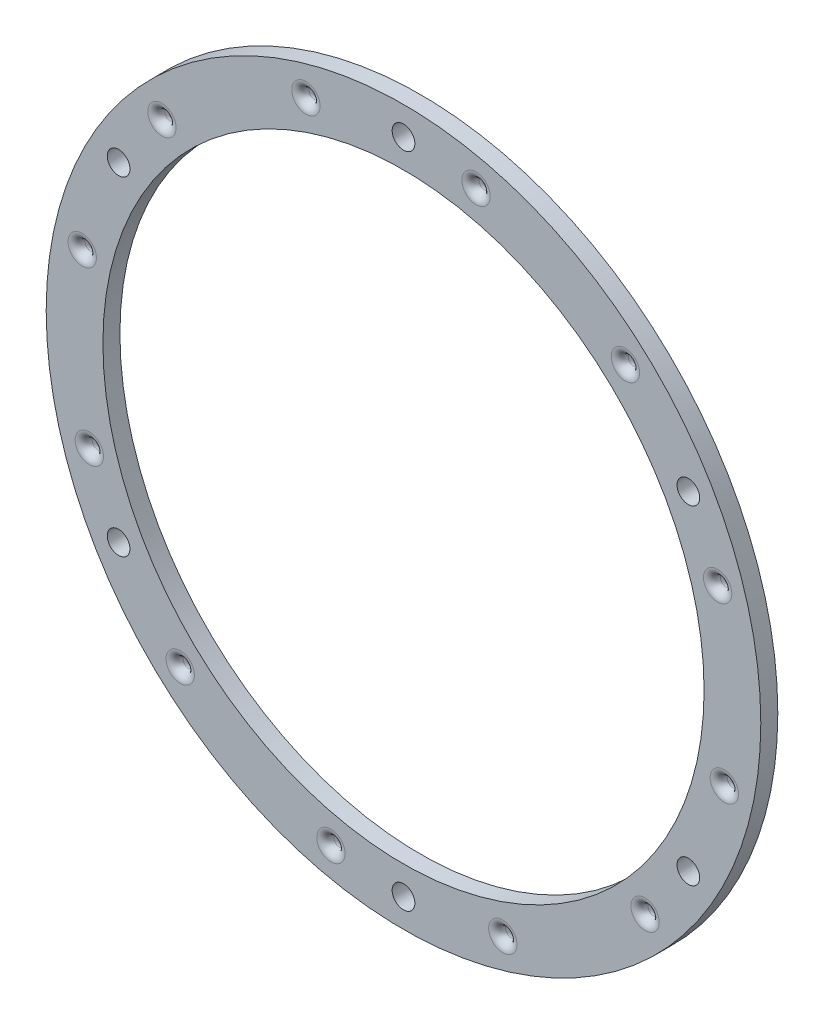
SolidWorks part; units mm, degrees
ref_plane "前视基准面" through (0, 0, 0) normal (0, 0, 1) x (1, 0, 0)
ref_plane "上视基准面" through (0, 0, 0) normal (0, 1, 0) x (1, 0, 0)
ref_plane "右视基准面" through (0, 0, 0) normal (1, 0, 0) x (0, 0, -1)
other "Configuration Table"
sketch "草图1" plane through (0, 0, 0) normal (0, 0, 1) x (1, 0, 0)
  line L0 (92.8146, -27.9977) -> (56.5708, -12.7963) construction
  line L1 (94.3787, 22.1606) -> (55.3899, 17.2035) construction
  line L2 (100.4589, 58) -> (0, 0) construction
  line L3 (70.654, 66.381) -> (39.1279, 42.8136) construction
  line L4 (33.6278, 38.6318) -> (56.5539, 56.0626) construction
  line L5 (27.9977, 92.8146) -> (12.7963, 56.5708) construction
  circle A0 centre (0, 0) radius 63
  circle A1 centre (0, 58) radius 2
  circle A22 centre (0, 0) radius 53
  circle A28 centre (50.2295, 29) radius 2
  circle A34 centre (50.2295, -29) radius 2
  circle A40 centre (0, -58) radius 2
  circle A46 centre (-50.2295, -29) radius 2
  circle A52 centre (-50.2295, 29) radius 2
  circle A58 centre (19.8372, 54.5022) radius 2
  circle A59 centre (37.2817, 44.4306) radius 2
  circle A60 centre (57.1188, 10.0716) radius 2
  circle A61 centre (57.1188, -10.0716) radius 2
  circle A62 centre (37.2817, -44.4306) radius 2
  circle A63 centre (19.8372, -54.5022) radius 2
  circle A64 centre (-19.8372, -54.5022) radius 2
  circle A65 centre (-37.2817, -44.4306) radius 2
  circle A66 centre (-57.1188, -10.0716) radius 2
  circle A67 centre (-57.1188, 10.0716) radius 2
  circle A68 centre (-37.2817, 44.4306) radius 2
  circle A69 centre (-19.8372, 54.5022) radius 2
  circle A70 centre (0, 0) radius 58 construction
  circle A71 centre (55.3899, 17.2035) radius 1
  circle A72 centre (56.5708, -12.7963) radius 1
  circle A73 centre (12.7963, 56.5708) radius 1
  circle A74 centre (39.1279, 42.8136) radius 1
  circle A75 centre (-39.3673, -42.5936) radius 1
  circle A76 centre (-12.7963, -56.5708) radius 1
  circle A77 centre (17.5137, -55.2926) radius 1
  circle A78 centre (42.5936, -39.3673) radius 1
  circle A79 centre (-17.2035, 55.3899) radius 1
  circle A80 centre (-42.5936, 39.3673) radius 1
  circle A81 centre (-56.6416, 12.479) radius 1
  circle A82 centre (-55.3899, -17.2035) radius 1
  point P23 (50.2295, 29)
  point P42 (0, 0)
  point P46 (0, 0)
  point P63 (0, 0)
  point P66 (0, 0)
  dimension "D1" = 126
  dimension "D3" = 4
  dimension "D5" = 106
  dimension "D6" = 18
  dimension "D4" = 2
  dimension "D7" = 2
  dimension "D8" = 2
  dimension "D9" = 2
  dimension "D2" = 58
extrude "凸台-拉伸1" add sketch "草图1" along normal blind 3
fillet "圆角1" radius 1.5 24 edges at (-54.3899, -17.2035, 0) (-55.6416, 12.479, 0) (-41.5936, 39.3673, 0) (-16.2035, 55.3899, 0) (13.7963, 56.5708, 0) (40.1279, 42.8136, 0) (56.3899, 17.2035, 0) (57.5708, -12.7963, 0) (43.5936, -39.3673, 0) (18.5137, -55.2926, 0) (-11.7963, -56.5708, 0) (-38.3673, -42.5936, 0) (13.7963, 56.5708, 3) (40.1279, 42.8136, 3) (56.3899, 17.2035, 3) (57.5708, -12.7963, 3) (43.5936, -39.3673, 3) (18.5137, -55.2926, 3) (-11.7963, -56.5708, 3) (-38.3673, -42.5936, 3) (-54.3899, -17.2035, 3) (-55.6416, 12.479, 3) (-41.5936, 39.3673, 3) (-16.2035, 55.3899, 3)
